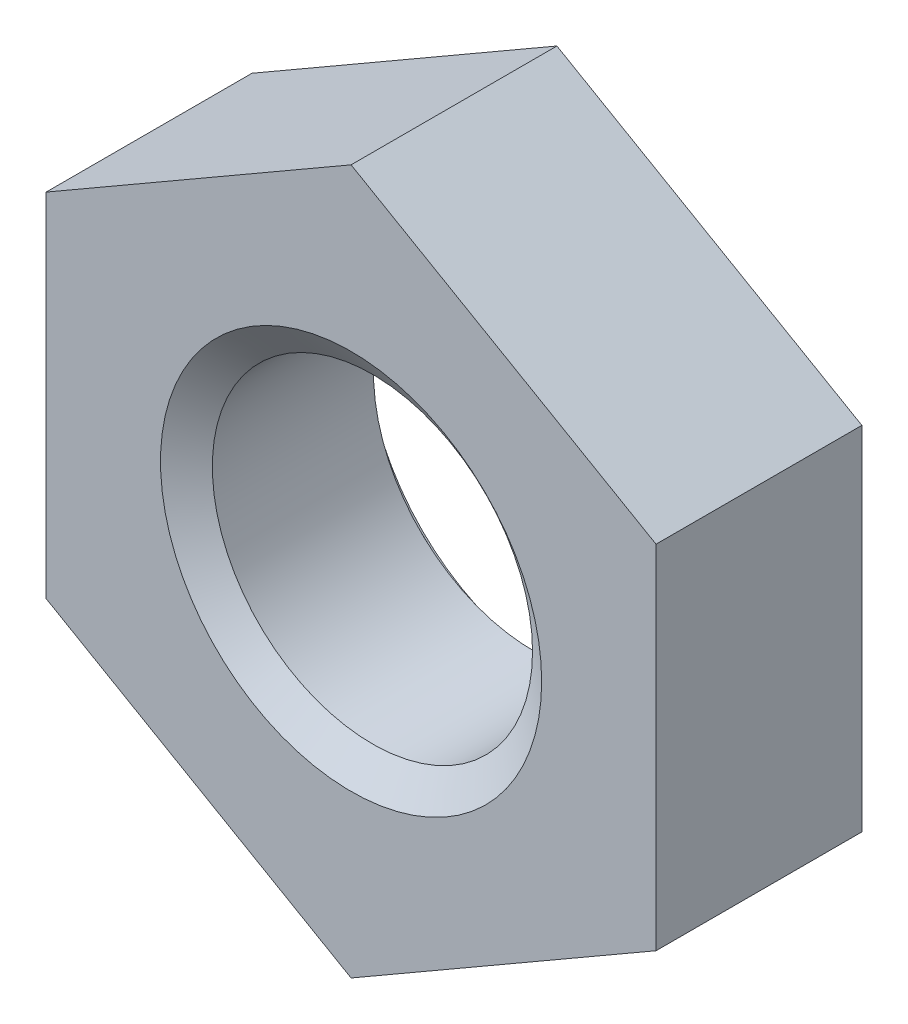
SolidWorks part; units mm, degrees
ref_plane "Plane1" through (0, 0, 0) normal (0, 0, 1) x (1, 0, 0)
ref_plane "Plane2" through (0, 0, 0) normal (0, 1, 0) x (1, 0, 0)
ref_plane "Plane3" through (0, 0, 0) normal (1, 0, 0) x (0, 0, -1)
revolve "EndChamfer" cut sketch "Sketch5"
sketch "Sketch5"
  line L0 (2.6746, 2.5) -> (2.3665, 2.06)
  line L1 (2.7254, 2.5) -> (2.6746, 2.5)
  line L2 (2.7254, 2.5) -> (2.7254, 2.06)
  line L3 (2.7254, 2.06) -> (2.3665, 2.06)
  line L6 (-0.0508, 2.5) -> (0, 2.5)
  line L7 (0, 2.5) -> (0.3081, 2.06)
  line L9 (0.3081, 2.06) -> (-0.0508, 2.06)
  line L10 (-0.0508, 2.06) -> (-0.0508, 2.5)
  line L11 (25.0375, 0) -> (38.388, 0) construction
  line L12 (2.7, 0) -> (0, 0) construction
extrude "BaseNut" add sketch "BaseNutSke" against normal blind 2.7
sketch "BaseNutSke" plane through (0, 0, 0) normal (0, 0, 1) x (1, 0, 0)
  line L6 (4, 2.3094) -> (4, -2.3094)
  line L7 (-4, 2.3094) -> (-4, -2.3094)
  line L8 (4, 2.3094) -> (0, 4.6188)
  line L9 (0, 4.6188) -> (-4, 2.3094)
  line L10 (-4, -2.3094) -> (0, -4.6188)
  line L11 (0, -4.6188) -> (4, -2.3094)
  circle A0 centre (0, 0) radius 2.1
  dimension "D4" = 4
  dimension "Tap_drill" = 4.2
  dimension "D1" = 120
  dimension "D2" = 4
  dimension "D3" = 4
  dimension "Width_flats" = 8
pattern_linear "ThdSchPat"
revolve "ThreadSchematic" cut sketch "ThdSchSke" angle 360 about L11
sketch "ThdSchSke" plane through (0, 0, 0) normal (0, 1, 0) x (1, 0, 0)
  line L0 (-2.5, 0.0254) -> (-2.1, 0.3055)
  line L1 (-2.1, 0.3055) -> (-1.05, 0.3055)
  line L2 (-1.05, 0.3055) -> (-1.05, -0.2547)
  line L3 (-1.05, -0.2547) -> (-2.1, -0.2547)
  line L4 (-2.1, -0.2547) -> (-2.5, 0.0254)
  line L5 (-3.175, 0.8) -> (3.175, 0.8) construction
  line L6 (0, 0.8) -> (0, -2.9874) construction
  line L7 (0, 2.3945) -> (0, 0.2801) construction
  dimension "D1" = 35
  dimension "VeeAngle" = 70
  dimension "SideAngle" = 55
  dimension "D2" = 0.0508
  dimension "OverCut" = 2.1
  dimension "Tap_Drill" = 4.2
  dimension "Advance" = 0.6623
  dimension "Thread_major" = 5
  dimension "Num_threads" = 5
  dimension "D4" = 50
  dimension "Offset1" = 2.7254
  dimension "ThreadMajor" = 2.5
  dimension "ChamferDepth" = 0.44
  dimension "Offset2" = 2.7762
equation "\"D2@BaseNutSke\" = \"Width_flats@BaseNutSke\" / 2"
equation "\"D3@BaseNutSke\" = \"Width_flats@BaseNutSke\" / 2"
equation "\"D4@BaseNutSke\" = \"D3@BaseNutSke\""
equation "\"Thread_major@ThdSchSke\" = \"Thread_major@ThreadCosmetic\""
equation "\"Tap_drill@ThdSchSke\" = \"Tap_drill@BaseNutSke\""
equation "\"Overcut@ThdSchSke\" = \"Tap_drill@ThdSchSke\" * 0.5"
equation "\"Num_threads@ThdSchPat\" = int(  ( \"Thickness@BaseNut\" - 0.0508 ) / \"Advance@ThdSchSke\" + 0.999 )  + 1"
equation "\"Advance@ThdSchPat\" = ( \"Thickness@BaseNut\" - 0.0508 ) /  (\"Num_threads@ThdSchPat\" - 1) 'relax it"
equation "' \"Num_threads@ThdSchPat\" = \"Num_threads@ThdSchPat\" - sgn( \"Num_threads@ThdSchPat\" - 1) '---chamfered tips only---"
equation "\"ThreadMajor@Sketch5\" = \"Thread_major@ThreadCosmetic\" * 0.5"
equation "\"ChamferDepth@Sketch5\" = (\"Thread_major@ThreadCosmetic\" - \"Tap_drill@BaseNutSke\") * 0.55"
equation "\"Offset1@Sketch5\" = \"Thickness@BaseNut\" + 0.0254"
equation "\"Offset2@Sketch5\" = \"Offset1@Sketch5\" + 0.0508"
